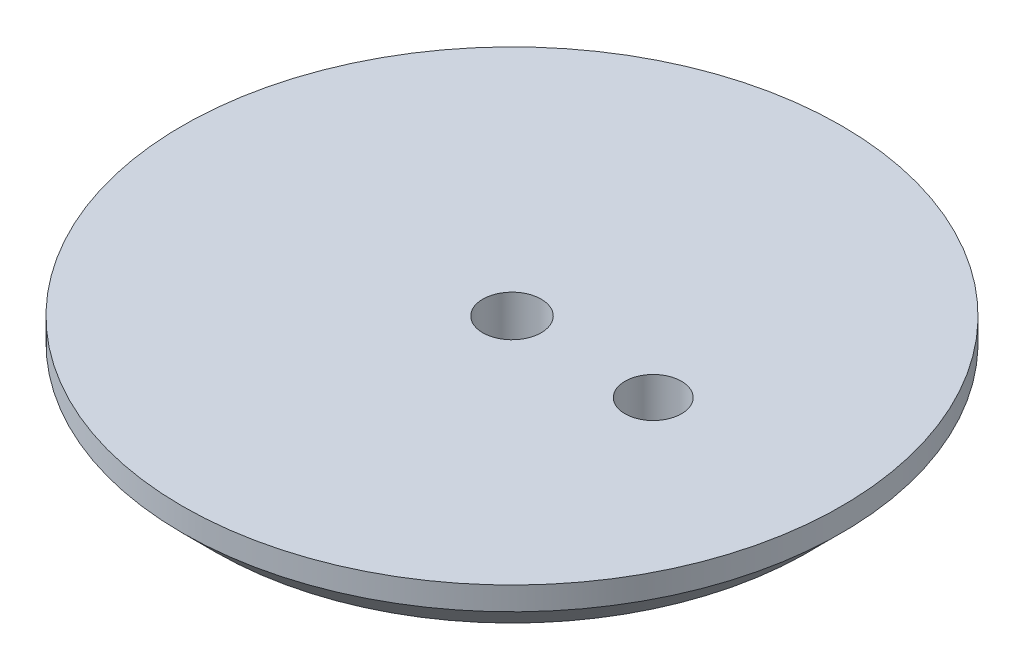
SolidWorks part; units mm, degrees
ref_plane "Plan de face" through (0, 0, 0) normal (0, 0, 1) x (1, 0, 0)
ref_plane "Plan de dessus" through (0, 0, 0) normal (0, 1, 0) x (1, 0, 0)
ref_plane "Plan de droite" through (0, 0, 0) normal (1, 0, 0) x (0, 0, -1)
sketch "Esquisse1" plane through (0, 0, 0) normal (0, 0, 1) x (1, 0, 0)
  line L0 (-56.3835, 0) -> (61.8399, 0) construction
  line L1 (35, 19.562) -> (35, -24.8631) construction
  line L2 (-6.2062, 6) -> (63.2833, 6) construction
  line L3 (25.1743, -6.2901) -> (65.4491, 33.9846) construction
  line L4 (37.4645, 6) -> (37.4645, 4.9754) construction
  line L5 (35, 6) -> (0, 6)
  line L6 (0, 6) -> (0, 0)
  line L7 (0, 0) -> (31.4645, 0)
  line L8 (35, 6) -> (35, 3.5355)
  line L9 (35, 3.5355) -> (31.4645, 0)
  line L10 (0, 18.0759) -> (0, -29.4515) construction
  circle A0 centre (35, 0) radius 2.5 construction
  dimension "D1" = 45
revolve "Révolution1" add sketch "Esquisse1" angle 360 about L10
sketch "Esquisse2" plane through (0, 6, 0) normal (0, 1, 0) x (-1, 0, 0)
  circle A0 centre (0, 0) radius 3.1
extrude "Enlèv. mat.-Extru.1" cut sketch "Esquisse2" against normal through all
sketch "Esquisse3" plane through (0, 6, 0) normal (0, 1, 0) x (-1, 0, 0)
  circle A0 centre (-15, 0) radius 3
  dimension "D2" = 6
  dimension "D1" = 15
extrude "Enlèv. mat.-Extru.2" cut sketch "Esquisse3" against normal blind 10
